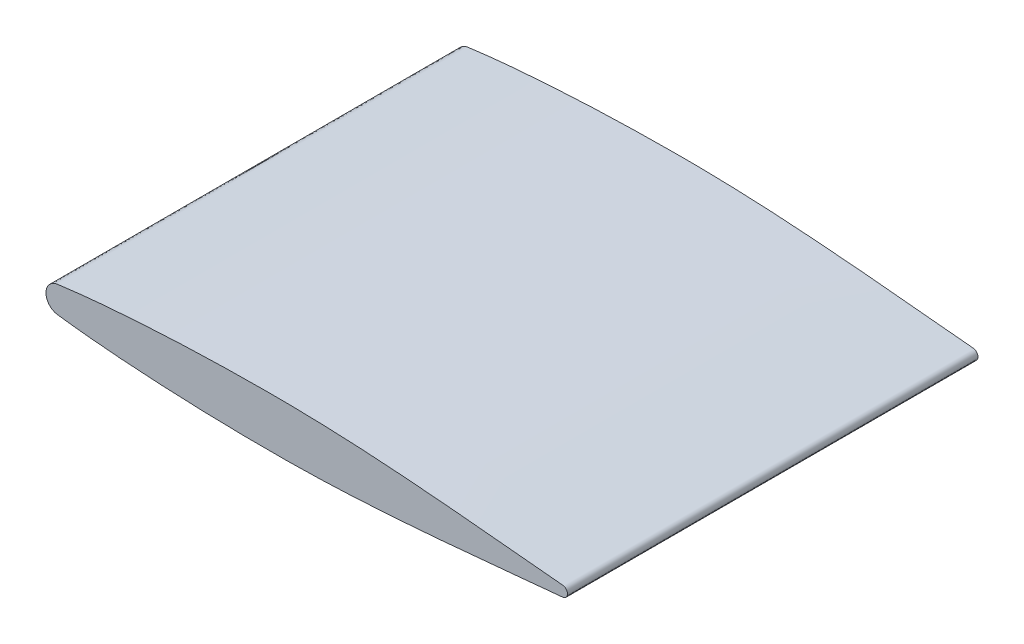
SolidWorks part; units mm, degrees
ref_plane "Ebene vorne" through (0, 0, 0) normal (0, 0, 1) x (1, 0, 0)
ref_plane "Ebene oben" through (0, 0, 0) normal (0, 1, 0) x (1, 0, 0)
ref_plane "Ebene rechts" through (0, 0, 0) normal (1, 0, 0) x (0, 0, -1)
sketch "Skizze1" plane through (0, 0, 0) normal (0, 0, 1) x (1, 0, 0)
  line L0 (1221.5917, -13.2023) -> (1226.5143, -12.7453) construction
  line L1 (1216.6082, -13.6746) -> (1221.5917, -13.2023) construction
  line L2 (1211.579, -14.1468) -> (1216.6082, -13.6746) construction
  line L3 (1206.4888, -14.6191) -> (1211.579, -14.1468) construction
  line L4 (1201.3377, -15.1065) -> (1206.4888, -14.6191) construction
  line L5 (1196.1408, -15.6093) -> (1201.3377, -15.1065) construction
  line L6 (1190.883, -16.112) -> (1196.1408, -15.6093) construction
  line L7 (1185.5795, -16.6147) -> (1190.883, -16.112) construction
  line L8 (1180.2302, -17.1326) -> (1185.5795, -16.6147) construction
  line L9 (1174.82, -17.6506) -> (1180.2302, -17.1326) construction
  line L10 (1169.3641, -18.1838) -> (1174.82, -17.6506) construction
  line L11 (1163.8472, -18.7017) -> (1169.3641, -18.1838) construction
  line L12 (1158.2845, -19.2501) -> (1163.8472, -18.7017) construction
  line L13 (1152.6762, -19.7985) -> (1158.2845, -19.2501) construction
  line L14 (1147.0221, -20.347) -> (1152.6762, -19.7985) construction
  line L15 (1141.3224, -20.8954) -> (1147.0221, -20.347) construction
  line L16 (1135.5616, -21.459) -> (1141.3224, -20.8954) construction
  line L17 (1129.7552, -22.0227) -> (1135.5616, -21.459) construction
  line L18 (1123.9182, -22.5863) -> (1129.7552, -22.0227) construction
  line L19 (1118.0203, -23.1652) -> (1123.9182, -22.5863) construction
  line L20 (1112.0767, -23.7441) -> (1118.0203, -23.1652) construction
  line L21 (1106.0873, -24.323) -> (1112.0767, -23.7441) construction
  line L22 (1100.0675, -24.9171) -> (1106.0873, -24.323) construction
  line L23 (1093.9867, -25.5112) -> (1100.0675, -24.9171) construction
  line L24 (1087.8755, -26.1054) -> (1093.9867, -25.5112) construction
  line L25 (1081.7185, -26.6995) -> (1087.8755, -26.1054) construction
  line L26 (1075.5158, -27.2936) -> (1081.7185, -26.6995) construction
  line L27 (1069.2674, -27.903) -> (1075.5158, -27.2936) construction
  line L28 (1062.9732, -28.4971) -> (1069.2674, -27.903) construction
  line L29 (1056.6486, -29.1064) -> (1062.9732, -28.4971) construction
  line L30 (1050.2935, -29.7158) -> (1056.6486, -29.1064) construction
  line L31 (1043.8774, -30.3251) -> (1050.2935, -29.7158) construction
  line L32 (1037.4309, -30.9345) -> (1043.8774, -30.3251) construction
  line L33 (1030.9539, -31.5438) -> (1037.4309, -30.9345) construction
  line L34 (1024.4311, -32.1684) -> (1030.9539, -31.5438) construction
  line L35 (1017.8779, -32.7777) -> (1024.4311, -32.1684) construction
  line L36 (1011.279, -33.3871) -> (1017.8779, -32.7777) construction
  line L37 (1004.6495, -33.9964) -> (1011.279, -33.3871) construction
  line L38 (997.9896, -34.621) -> (1004.6495, -33.9964) construction
  line L39 (991.2992, -35.2303) -> (997.9896, -34.621) construction
  line L40 (984.5631, -35.8549) -> (991.2992, -35.2303) construction
  line L41 (977.7966, -36.4642) -> (984.5631, -35.8549) construction
  line L42 (970.9995, -37.0736) -> (977.7966, -36.4642) construction
  line L43 (964.1719, -37.6981) -> (970.9995, -37.0736) construction
  line L44 (957.2987, -38.3075) -> (964.1719, -37.6981) construction
  line L45 (950.4102, -38.9168) -> (957.2987, -38.3075) construction
  line L46 (943.4912, -39.5261) -> (950.4102, -38.9168) construction
  line L47 (936.5417, -40.1355) -> (943.4912, -39.5261) construction
  line L48 (929.5618, -40.7295) -> (936.5417, -40.1355) construction
  line L49 (922.5514, -41.3389) -> (929.5618, -40.7295) construction
  line L50 (915.5105, -41.933) -> (922.5514, -41.3389) construction
  line L51 (908.4543, -42.527) -> (915.5105, -41.933) construction
  line L52 (901.3677, -43.1211) -> (908.4543, -42.527) construction
  line L53 (894.2506, -43.7) -> (901.3677, -43.1211) construction
  line L54 (887.1182, -44.2788) -> (894.2506, -43.7) construction
  line L55 (879.9554, -44.8576) -> (887.1182, -44.2788) construction
  line L56 (872.7621, -45.4365) -> (879.9554, -44.8576) construction
  line L57 (865.5536, -46.0001) -> (872.7621, -45.4365) construction
  line L58 (858.3298, -46.5637) -> (865.5536, -46.0001) construction
  line L59 (851.0755, -47.112) -> (858.3298, -46.5637) construction
  line L60 (843.806, -47.6604) -> (851.0755, -47.112) construction
  line L61 (836.506, -48.1935) -> (843.806, -47.6604) construction
  line L62 (829.1908, -48.7266) -> (836.506, -48.1935) construction
  line L63 (821.8604, -49.2597) -> (829.1908, -48.7266) construction
  line L64 (814.5147, -49.7776) -> (821.8604, -49.2597) construction
  line L65 (807.1537, -50.2955) -> (814.5147, -49.7776) construction
  line L66 (799.7775, -50.7981) -> (807.1537, -50.2955) construction
  line L67 (792.3709, -51.3007) -> (799.7775, -50.7981) construction
  line L68 (784.9642, -51.7881) -> (792.3709, -51.3007) construction
  line L69 (777.5271, -52.2603) -> (784.9642, -51.7881) construction
  line L70 (770.09, -52.7324) -> (777.5271, -52.2603) construction
  line L71 (762.6376, -53.1893) -> (770.09, -52.7324) construction
  line L72 (755.17, -53.6462) -> (762.6376, -53.1893) construction
  line L73 (747.7023, -54.0879) -> (755.17, -53.6462) construction
  line L74 (740.2042, -54.5143) -> (747.7023, -54.0879) construction
  line L75 (732.7061, -54.9255) -> (740.2042, -54.5143) construction
  line L76 (725.208, -55.3367) -> (732.7061, -54.9255) construction
  line L77 (717.6795, -55.7174) -> (725.208, -55.3367) construction
  line L78 (710.1661, -56.0981) -> (717.6795, -55.7174) construction
  line L79 (702.6223, -56.4636) -> (710.1661, -56.0981) construction
  line L80 (695.0938, -56.829) -> (702.6223, -56.4636) construction
  line L81 (687.5499, -57.164) -> (695.0938, -56.829) construction
  line L82 (679.9909, -57.499) -> (687.5499, -57.164) construction
  line L83 (672.4471, -57.8035) -> (679.9909, -57.499) construction
  line L84 (664.888, -58.0928) -> (672.4471, -57.8035) construction
  line L85 (657.329, -58.382) -> (664.888, -58.0928) construction
  line L86 (649.7699, -58.656) -> (657.329, -58.382) construction
  line L87 (642.2109, -58.8996) -> (649.7699, -58.656) construction
  line L88 (634.6366, -59.1431) -> (642.2109, -58.8996) construction
  line L89 (627.0775, -59.3562) -> (634.6366, -59.1431) construction
  line L90 (619.5185, -59.5692) -> (627.0775, -59.3562) construction
  line L91 (611.9594, -59.7671) -> (619.5185, -59.5692) construction
  line L92 (604.4004, -59.9497) -> (611.9594, -59.7671) construction
  line L93 (596.8413, -60.1018) -> (604.4004, -59.9497) construction
  line L94 (589.2975, -60.2539) -> (596.8413, -60.1018) construction
  line L95 (581.7537, -60.3907) -> (589.2975, -60.2539) construction
  line L96 (574.2099, -60.5123) -> (581.7537, -60.3907) construction
  line L97 (566.6814, -60.6187) -> (574.2099, -60.5123) construction
  line L98 (559.1528, -60.7251) -> (566.6814, -60.6187) construction
  line L99 (551.6395, -60.801) -> (559.1528, -60.7251) construction
  line L100 (544.1262, -60.8617) -> (551.6395, -60.801) construction
  line L101 (536.6281, -60.9224) -> (544.1262, -60.8617) construction
  line L102 (529.13, -60.9525) -> (536.6281, -60.9224) construction
  line L103 (521.6624, -60.9827) -> (529.13, -60.9525) construction
  line L104 (514.1795, -60.9977) -> (521.6624, -60.9827) construction
  line L105 (506.7272, -60.9821) -> (514.1795, -60.9977) construction
  line L106 (499.2901, -60.9666) -> (506.7272, -60.9821) construction
  line L107 (491.8529, -60.9511) -> (499.2901, -60.9666) construction
  line L108 (484.4463, -60.9051) -> (491.8529, -60.9511) construction
  line L109 (477.0397, -60.8591) -> (484.4463, -60.9051) construction
  line L110 (469.6635, -60.7978) -> (477.0397, -60.8591) construction
  line L111 (462.3026, -60.7213) -> (469.6635, -60.7978) construction
  line L112 (454.9417, -60.6296) -> (462.3026, -60.7213) construction
  line L113 (447.6112, -60.5379) -> (454.9417, -60.6296) construction
  line L114 (440.3113, -60.4309) -> (447.6112, -60.5379) construction
  line L115 (433.0113, -60.3239) -> (440.3113, -60.4309) construction
  line L116 (425.7419, -60.2017) -> (433.0113, -60.3239) construction
  line L117 (418.4876, -60.0643) -> (425.7419, -60.2017) construction
  line L118 (411.2639, -59.9116) -> (418.4876, -60.0643) construction
  line L119 (404.0554, -59.7589) -> (411.2639, -59.9116) construction
  line L120 (396.8773, -59.6062) -> (404.0554, -59.7589) construction
  line L121 (389.7145, -59.4383) -> (396.8773, -59.6062) construction
  line L122 (382.5822, -59.2551) -> (389.7145, -59.4383) construction
  line L123 (375.4651, -59.072) -> (382.5822, -59.2551) construction
  line L124 (368.3786, -58.8736) -> (375.4651, -59.072) construction
  line L125 (361.3224, -58.6599) -> (368.3786, -58.8736) construction
  line L126 (354.2968, -58.4463) -> (361.3224, -58.6599) construction
  line L127 (347.2864, -58.2327) -> (354.2968, -58.4463) construction
  line L128 (340.3217, -58.0038) -> (347.2864, -58.2327) construction
  line L129 (333.3723, -57.7597) -> (340.3217, -58.0038) construction
  line L130 (326.4534, -57.5156) -> (333.3723, -57.7597) construction
  line L131 (319.5801, -57.2562) -> (326.4534, -57.5156) construction
  line L132 (312.7221, -56.9816) -> (319.5801, -57.2562) construction
  line L133 (305.8946, -56.7223) -> (312.7221, -56.9816) construction
  line L134 (299.1128, -56.4325) -> (305.8946, -56.7223) construction
  line L135 (292.3615, -56.1426) -> (299.1128, -56.4325) construction
  line L136 (285.6407, -55.8528) -> (292.3615, -56.1426) construction
  line L137 (278.9504, -55.5478) -> (285.6407, -55.8528) construction
  line L138 (272.3057, -55.2427) -> (278.9504, -55.5478) construction
  line L139 (265.6916, -54.9224) -> (272.3057, -55.2427) construction
  line L140 (259.1079, -54.5869) -> (265.6916, -54.9224) construction
  line L141 (252.57, -54.2666) -> (259.1079, -54.5869) construction
  line L142 (246.0625, -53.9158) -> (252.57, -54.2666) construction
  line L143 (239.6008, -53.5802) -> (246.0625, -53.9158) construction
  line L144 (233.1847, -53.2142) -> (239.6008, -53.5802) construction
  line L145 (226.7992, -52.8635) -> (233.1847, -53.2142) construction
  line L146 (220.4441, -52.4975) -> (226.7992, -52.8635) construction
  line L147 (214.15, -52.1162) -> (220.4441, -52.4975) construction
  line L148 (207.8864, -51.735) -> (214.15, -52.1162) construction
  line L149 (201.6685, -51.3537) -> (207.8864, -51.735) construction
  line L150 (195.4811, -50.9572) -> (201.6685, -51.3537) construction
  line L151 (189.3546, -50.5608) -> (195.4811, -50.9572) construction
  line L152 (183.2586, -50.149) -> (189.3546, -50.5608) construction
  line L153 (177.2236, -49.7526) -> (183.2586, -50.149) construction
  line L154 (171.219, -49.3256) -> (177.2236, -49.7526) construction
  line L155 (165.2755, -48.9139) -> (171.219, -49.3256) construction
  line L156 (159.3624, -48.4717) -> (165.2755, -48.9139) construction
  line L157 (153.495, -48.0447) -> (159.3624, -48.4717) construction
  line L158 (147.6886, -47.6026) -> (153.495, -48.0447) construction
  line L159 (141.9279, -47.1604) -> (147.6886, -47.6026) construction
  line L160 (136.2129, -46.7029) -> (141.9279, -47.1604) construction
  line L161 (130.5436, -46.2608) -> (136.2129, -46.7029) construction
  line L162 (124.9201, -45.7881) -> (130.5436, -46.2608) construction
  line L163 (119.3575, -45.3307) -> (124.9201, -45.7881) construction
  line L164 (113.8406, -44.858) -> (119.3575, -45.3307) construction
  line L165 (108.3847, -44.3854) -> (113.8406, -44.858) construction
  line L166 (102.9745, -43.9127) -> (108.3847, -44.3854) construction
  line L167 (97.6101, -43.4248) -> (102.9745, -43.9127) construction
  line L168 (92.3066, -42.9369) -> (97.6101, -43.4248) construction
  line L169 (87.0488, -42.4491) -> (92.3066, -42.9369) construction
  line L170 (81.852, -41.9459) -> (87.0488, -42.4491) construction
  line L171 (76.7161, -41.4428) -> (81.852, -41.9459) construction
  line L172 (71.626, -40.9397) -> (76.7161, -41.4428) construction
  line L173 (66.5816, -40.4213) -> (71.626, -40.9397) construction
  line L174 (61.6133, -39.9182) -> (66.5816, -40.4213) construction
  line L175 (56.6908, -39.3999) -> (61.6133, -39.9182) construction
  line L176 (51.8293, -38.8815) -> (56.6908, -39.3999) construction
  line L177 (47.0287, -38.3479) -> (51.8293, -38.8815) construction
  line L178 (42.2739, -37.8143) -> (47.0287, -38.3479) construction
  line L179 (37.58, -37.296) -> (42.2739, -37.8143) construction
  line L180 (32.9623, -36.7472) -> (37.58, -37.296) construction
  line L181 (28.3903, -36.2136) -> (32.9623, -36.7472) construction
  line L182 (23.8793, -35.6648) -> (28.3903, -36.2136) construction
  line L183 (19.4292, -35.1312) -> (23.8793, -35.6648) construction
  line L184 (15.0401, -34.5824) -> (19.4292, -35.1312) construction
  line L185 (10.712, -34.0336) -> (15.0401, -34.5824) construction
  line L186 (6.4448, -33.4695) -> (10.712, -34.0336) construction
  line L187 (2.2386, -32.9207) -> (6.4448, -33.4695) construction
  line L188 (-1.9067, -32.3719) -> (2.2386, -32.9207) construction
  line L189 (-5.9443, -31.8143) -> (-1.9067, -32.3719) construction
  line L190 (-5.943, 31.7615) -> (-1.9054, 32.3189) construction
  line L191 (-1.9054, 32.3189) -> (2.2399, 32.8675) construction
  line L192 (2.2399, 32.8675) -> (6.4461, 33.4162) construction
  line L193 (6.4461, 33.4162) -> (10.7133, 33.9801) construction
  line L194 (10.7133, 33.9801) -> (15.0415, 34.5287) construction
  line L195 (15.0415, 34.5287) -> (19.4306, 35.0773) construction
  line L196 (19.4306, 35.0773) -> (23.8807, 35.6107) construction
  line L197 (23.8807, 35.6107) -> (28.3917, 36.1594) construction
  line L198 (28.3917, 36.1594) -> (32.9637, 36.6928) construction
  line L199 (32.9637, 36.6928) -> (37.5814, 37.2414) construction
  line L200 (37.5814, 37.2414) -> (42.2753, 37.7596) construction
  line L201 (42.2753, 37.7596) -> (47.0302, 38.293) construction
  line L202 (47.0302, 38.293) -> (51.8308, 38.8264) construction
  line L203 (51.8308, 38.8264) -> (56.6924, 39.3445) construction
  line L204 (56.6924, 39.3445) -> (61.6149, 39.8627) construction
  line L205 (61.6149, 39.8627) -> (66.5831, 40.3656) construction
  line L206 (66.5831, 40.3656) -> (71.6276, 40.8838) construction
  line L207 (71.6276, 40.8838) -> (76.7177, 41.3867) construction
  line L208 (76.7177, 41.3867) -> (81.8536, 41.8896) construction
  line L209 (81.8536, 41.8896) -> (87.0505, 42.3925) construction
  line L210 (87.0505, 42.3925) -> (92.3083, 42.8802) construction
  line L211 (92.3083, 42.8802) -> (97.6118, 43.3679) construction
  line L212 (97.6118, 43.3679) -> (102.9763, 43.8556) construction
  line L213 (102.9763, 43.8556) -> (108.3865, 44.328) construction
  line L214 (108.3865, 44.328) -> (113.8424, 44.8005) construction
  line L215 (113.8424, 44.8005) -> (119.3593, 45.2729) construction
  line L216 (119.3593, 45.2729) -> (124.9219, 45.7301) construction
  line L217 (124.9219, 45.7301) -> (130.5454, 46.2025) construction
  line L218 (130.5454, 46.2025) -> (136.2147, 46.6445) construction
  line L219 (136.2147, 46.6445) -> (141.9297, 47.1017) construction
  line L220 (141.9297, 47.1017) -> (147.6904, 47.5437) construction
  line L221 (147.6904, 47.5437) -> (153.4969, 47.9856) construction
  line L222 (153.4969, 47.9856) -> (159.3643, 48.4123) construction
  line L223 (159.3643, 48.4123) -> (165.2774, 48.8543) construction
  line L224 (165.2774, 48.8543) -> (171.221, 49.2658) construction
  line L225 (171.221, 49.2658) -> (177.2255, 49.6925) construction
  line L226 (177.2255, 49.6925) -> (183.2606, 50.0887) construction
  line L227 (183.2606, 50.0887) -> (189.3566, 50.5002) construction
  line L228 (189.3566, 50.5002) -> (195.4831, 50.8965) construction
  line L229 (195.4831, 50.8965) -> (201.6705, 51.2927) construction
  line L230 (201.6705, 51.2927) -> (207.8884, 51.6737) construction
  line L231 (207.8884, 51.6737) -> (214.1521, 52.0547) construction
  line L232 (214.1521, 52.0547) -> (220.4462, 52.4357) construction
  line L233 (220.4462, 52.4357) -> (226.8013, 52.8015) construction
  line L234 (226.8013, 52.8015) -> (233.1868, 53.152) construction
  line L235 (233.1868, 53.152) -> (239.6029, 53.5177) construction
  line L236 (239.6029, 53.5177) -> (246.0646, 53.853) construction
  line L237 (246.0646, 53.853) -> (252.5721, 54.2035) construction
  line L238 (252.5721, 54.2035) -> (259.1101, 54.5236) construction
  line L239 (259.1101, 54.5236) -> (265.6937, 54.8589) construction
  line L240 (265.6937, 54.8589) -> (272.3079, 55.1789) construction
  line L241 (272.3079, 55.1789) -> (278.9525, 55.4837) construction
  line L242 (278.9525, 55.4837) -> (285.6429, 55.7885) construction
  line L243 (285.6429, 55.7885) -> (292.3637, 56.0781) construction
  line L244 (292.3637, 56.0781) -> (299.1151, 56.3676) construction
  line L245 (299.1151, 56.3676) -> (305.8969, 56.6572) construction
  line L246 (305.8969, 56.6572) -> (312.7244, 56.9163) construction
  line L247 (312.7244, 56.9163) -> (319.5824, 57.1906) construction
  line L248 (319.5824, 57.1906) -> (326.4556, 57.4497) construction
  line L249 (326.4556, 57.4497) -> (333.3746, 57.6935) construction
  line L250 (333.3746, 57.6935) -> (340.324, 57.9373) construction
  line L251 (340.324, 57.9373) -> (347.2887, 58.1659) construction
  line L252 (347.2887, 58.1659) -> (354.2991, 58.3793) construction
  line L253 (354.2991, 58.3793) -> (361.3247, 58.5927) construction
  line L254 (361.3247, 58.5927) -> (368.3809, 58.806) construction
  line L255 (368.3809, 58.806) -> (375.4675, 59.0041) construction
  line L256 (375.4675, 59.0041) -> (382.5845, 59.187) construction
  line L257 (382.5845, 59.187) -> (389.7169, 59.3699) construction
  line L258 (389.7169, 59.3699) -> (396.8797, 59.5375) construction
  line L259 (396.8797, 59.5375) -> (404.0577, 59.6899) construction
  line L260 (404.0577, 59.6899) -> (411.2662, 59.8423) construction
  line L261 (411.2662, 59.8423) -> (418.49, 59.9947) construction
  line L262 (418.49, 59.9947) -> (425.7442, 60.1319) construction
  line L263 (425.7442, 60.1319) -> (433.0137, 60.2538) construction
  line L264 (433.0137, 60.2538) -> (440.3137, 60.3605) construction
  line L265 (440.3137, 60.3605) -> (447.6136, 60.4672) construction
  line L266 (447.6136, 60.4672) -> (454.9441, 60.5586) construction
  line L267 (454.9441, 60.5586) -> (462.305, 60.6501) construction
  line L268 (462.305, 60.6501) -> (469.6659, 60.7263) construction
  line L269 (469.6659, 60.7263) -> (477.0421, 60.7872) construction
  line L270 (477.0421, 60.7872) -> (484.4487, 60.8329) construction
  line L271 (484.4487, 60.8329) -> (491.8553, 60.8787) construction
  line L272 (491.8553, 60.8787) -> (499.2925, 60.8939) construction
  line L273 (499.2925, 60.8939) -> (506.7296, 60.9091) construction
  line L274 (506.7296, 60.9091) -> (514.1819, 60.9244) construction
  line L275 (514.1819, 60.9244) -> (521.6648, 60.9091) construction
  line L276 (521.6648, 60.9091) -> (529.1324, 60.8787) construction
  line L277 (529.1324, 60.8787) -> (536.6305, 60.8482) construction
  line L278 (536.6305, 60.8482) -> (544.1285, 60.7872) construction
  line L279 (544.1285, 60.7872) -> (551.6419, 60.7263) construction
  line L280 (551.6419, 60.7263) -> (559.1552, 60.6501) construction
  line L281 (559.1552, 60.6501) -> (566.6837, 60.5434) construction
  line L282 (566.6837, 60.5434) -> (574.2123, 60.4367) construction
  line L283 (574.2123, 60.4367) -> (581.7561, 60.3148) construction
  line L284 (581.7561, 60.3148) -> (589.2999, 60.1776) construction
  line L285 (589.2999, 60.1776) -> (596.8437, 60.0252) construction
  line L286 (596.8437, 60.0252) -> (604.4027, 59.8728) construction
  line L287 (604.4027, 59.8728) -> (611.9618, 59.6899) construction
  line L288 (611.9618, 59.6899) -> (619.5208, 59.4918) construction
  line L289 (619.5208, 59.4918) -> (627.0799, 59.2785) construction
  line L290 (627.0799, 59.2785) -> (634.6389, 59.0651) construction
  line L291 (634.6389, 59.0651) -> (642.2132, 58.8213) construction
  line L292 (642.2132, 58.8213) -> (649.7722, 58.5774) construction
  line L293 (649.7722, 58.5774) -> (657.3313, 58.3031) construction
  line L294 (657.3313, 58.3031) -> (664.8903, 58.0135) construction
  line L295 (664.8903, 58.0135) -> (672.4493, 57.724) construction
  line L296 (672.4493, 57.724) -> (679.9931, 57.4192) construction
  line L297 (679.9931, 57.4192) -> (687.5522, 57.0839) construction
  line L298 (687.5522, 57.0839) -> (695.096, 56.7486) construction
  line L299 (695.096, 56.7486) -> (702.6245, 56.3829) construction
  line L300 (702.6245, 56.3829) -> (710.1683, 56.0171) construction
  line L301 (710.1683, 56.0171) -> (717.6817, 55.6361) construction
  line L302 (717.6817, 55.6361) -> (725.2102, 55.2551) construction
  line L303 (725.2102, 55.2551) -> (732.7083, 54.8436) construction
  line L304 (732.7083, 54.8436) -> (740.2064, 54.4321) construction
  line L305 (740.2064, 54.4321) -> (747.7045, 54.0054) construction
  line L306 (747.7045, 54.0054) -> (755.1721, 53.5635) construction
  line L307 (755.1721, 53.5635) -> (762.6397, 53.1063) construction
  line L308 (762.6397, 53.1063) -> (770.092, 52.6491) construction
  line L309 (770.092, 52.6491) -> (777.5291, 52.1766) construction
  line L310 (777.5291, 52.1766) -> (784.9663, 51.7042) construction
  line L311 (784.9663, 51.7042) -> (792.3729, 51.2165) construction
  line L312 (792.3729, 51.2165) -> (799.7795, 50.7136) construction
  line L313 (799.7795, 50.7136) -> (807.1557, 50.2107) construction
  line L314 (807.1557, 50.2107) -> (814.5166, 49.6925) construction
  line L315 (814.5166, 49.6925) -> (821.8623, 49.1743) construction
  line L316 (821.8623, 49.1743) -> (829.1927, 48.6409) construction
  line L317 (829.1927, 48.6409) -> (836.5079, 48.1075) construction
  line L318 (836.5079, 48.1075) -> (843.8079, 47.5741) construction
  line L319 (843.8079, 47.5741) -> (851.0774, 47.0255) construction
  line L320 (851.0774, 47.0255) -> (858.3316, 46.4769) construction
  line L321 (858.3316, 46.4769) -> (865.5554, 45.913) construction
  line L322 (865.5554, 45.913) -> (872.7639, 45.3491) construction
  line L323 (872.7639, 45.3491) -> (879.9572, 44.77) construction
  line L324 (879.9572, 44.77) -> (887.12, 44.1909) construction
  line L325 (887.12, 44.1909) -> (894.2523, 43.6117) construction
  line L326 (894.2523, 43.6117) -> (901.3694, 43.0326) construction
  line L327 (901.3694, 43.0326) -> (908.456, 42.4383) construction
  line L328 (908.456, 42.4383) -> (915.5121, 41.8439) construction
  line L329 (915.5121, 41.8439) -> (922.553, 41.2495) construction
  line L330 (922.553, 41.2495) -> (929.5634, 40.6399) construction
  line L331 (929.5634, 40.6399) -> (936.5433, 40.0456) construction
  line L332 (936.5433, 40.0456) -> (943.4927, 39.436) construction
  line L333 (943.4927, 39.436) -> (950.4117, 38.8264) construction
  line L334 (950.4117, 38.8264) -> (957.3002, 38.2168) construction
  line L335 (957.3002, 38.2168) -> (964.1734, 37.6072) construction
  line L336 (964.1734, 37.6072) -> (971.0009, 36.9823) construction
  line L337 (971.0009, 36.9823) -> (977.798, 36.3727) construction
  line L338 (977.798, 36.3727) -> (984.5645, 35.7631) construction
  line L339 (984.5645, 35.7631) -> (991.3006, 35.1383) construction
  line L340 (991.3006, 35.1383) -> (997.991, 34.5287) construction
  line L341 (997.991, 34.5287) -> (1004.6509, 33.9039) construction
  line L342 (1004.6509, 33.9039) -> (1011.2803, 33.2943) construction
  line L343 (1011.2803, 33.2943) -> (1017.8792, 32.6847) construction
  line L344 (1017.8792, 32.6847) -> (1024.4324, 32.0751) construction
  line L345 (1024.4324, 32.0751) -> (1030.9551, 31.4502) construction
  line L346 (1030.9551, 31.4502) -> (1037.4321, 30.8406) construction
  line L347 (1037.4321, 30.8406) -> (1043.8786, 30.231) construction
  line L348 (1043.8786, 30.231) -> (1050.2947, 29.6214) construction
  line L349 (1050.2947, 29.6214) -> (1056.6497, 29.0118) construction
  line L350 (1056.6497, 29.0118) -> (1062.9743, 28.4022) construction
  line L351 (1062.9743, 28.4022) -> (1069.2685, 27.8079) construction
  line L352 (1069.2685, 27.8079) -> (1075.5169, 27.1983) construction
  line L353 (1075.5169, 27.1983) -> (1081.7195, 26.6039) construction
  line L354 (1081.7195, 26.6039) -> (1087.8765, 26.0095) construction
  line L355 (1087.8765, 26.0095) -> (1093.9877, 25.4152) construction
  line L356 (1093.9877, 25.4152) -> (1100.0685, 24.8208) construction
  line L357 (1100.0685, 24.8208) -> (1106.0883, 24.2265) construction
  line L358 (1106.0883, 24.2265) -> (1112.0776, 23.6473) construction
  line L359 (1112.0776, 23.6473) -> (1118.0212, 23.0682) construction
  line L360 (1118.0212, 23.0682) -> (1123.9191, 22.4891) construction
  line L361 (1123.9191, 22.4891) -> (1129.756, 21.9252) construction
  line L362 (1129.756, 21.9252) -> (1135.5625, 21.3613) construction
  line L363 (1135.5625, 21.3613) -> (1141.3232, 20.7975) construction
  line L364 (1141.3232, 20.7975) -> (1147.0229, 20.2488) construction
  line L365 (1147.0229, 20.2488) -> (1152.677, 19.7002) construction
  line L366 (1152.677, 19.7002) -> (1158.2853, 19.1515) construction
  line L367 (1158.2853, 19.1515) -> (1163.8479, 18.6029) construction
  line L368 (1163.8479, 18.6029) -> (1169.3648, 18.0847) construction
  line L369 (1169.3648, 18.0847) -> (1174.8207, 17.5513) construction
  line L370 (1174.8207, 17.5513) -> (1180.2309, 17.0332) construction
  line L371 (1180.2309, 17.0332) -> (1185.5801, 16.515) construction
  line L372 (1185.5801, 16.515) -> (1190.8837, 16.0121) construction
  line L373 (1190.8837, 16.0121) -> (1196.1415, 15.5092) construction
  line L374 (1196.1415, 15.5092) -> (1201.3383, 15.0063) construction
  line L375 (1201.3383, 15.0063) -> (1206.4894, 14.5186) construction
  line L376 (1206.4894, 14.5186) -> (1211.5796, 14.0461) construction
  line L377 (1211.5796, 14.0461) -> (1216.6088, 13.5737) construction
  line L378 (1216.6088, 13.5737) -> (1221.5923, 13.1013) construction
  line L379 (1221.5923, 13.1013) -> (1226.5148, 12.6441) construction
  arc A0 (1238.0352, -0.051) -> (1226.5143, -12.7453) centre (1225.2805, -0.0505) cw construction
  arc A1 (-5.943, 31.7659) -> (-32.3649, -0.0237) centre (0, -0.0486) ccw construction
  arc A2 (1238.0352, -0.051) -> (1226.5148, 12.6438) centre (1225.2805, -0.051) ccw construction
  arc A3 (-5.9443, -31.8143) -> (-32.3649, -0.0237) centre (0, 0) cw construction
  spline S0 degree 3 number of poles 3025 (-4.9336, 31.9008) -> (-4.9336, 31.9008)
extrude "Linear austragen1" add sketch "Skizze1" along normal blind 1000
